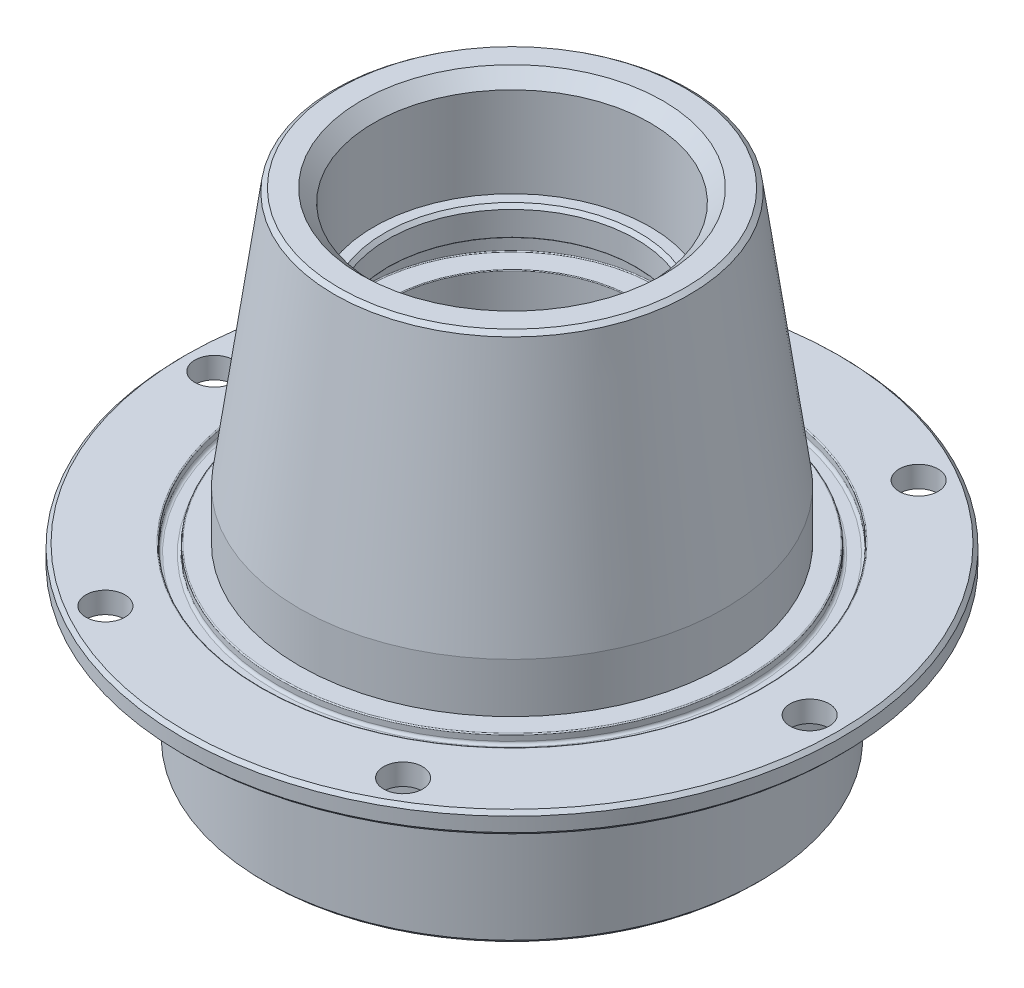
SolidWorks part; units mm, degrees
ref_plane "Face" through (0, 0, 0) normal (0, 0, 1) x (1, 0, 0)
ref_plane "Dessus" through (0, 0, 0) normal (0, 1, 0) x (1, 0, 0)
ref_plane "Droite" through (0, 0, 0) normal (1, 0, 0) x (0, 0, -1)
sketch "Esquisse1" plane through (0, 0, 0) normal (0, 0, 1) x (1, 0, 0)
  line L0 (0, 58.1117) -> (0, -113.1802) construction
  line L1 (-19.5, 0) -> (-25, 0)
  line L2 (-25, 0) -> (-30, -36.4064)
  line L3 (-19.5, 0) -> (-19.5, -14.5)
  line L4 (-19.5, -14.5) -> (-17.5, -14.5)
  line L5 (-30, -36.4064) -> (-30, -43.4064)
  line L6 (-17.5, -14.5) -> (-17.5, -18.5)
  line L7 (-17.5, -46.5) -> (-27, -46.5)
  line L8 (-27, -46.5) -> (-27, -47)
  line L9 (-27, -47) -> (-31, -47)
  line L10 (-31, -47) -> (-31, -61)
  line L11 (-31, -63.2) -> (-31, -67.7)
  line L12 (-31, -61) -> (-32.5, -61)
  line L13 (-31, -67.7) -> (-35, -67.7)
  line L14 (-31, -63.2) -> (-32.5, -63.2)
  line L15 (-32.5, -61) -> (-32.5, -63.2)
  line L16 (-35, -67.7) -> (-35, -46.4064)
  line L17 (-35, -46.4064) -> (-46.5, -46.4064)
  line L18 (-46.5, -46.4064) -> (-46.5, -43.4064)
  line L19 (-46.5, -43.4064) -> (-35.28, -43.4064)
  line L20 (-33, -43.4064) -> (-30, -43.4064)
  line L21 (-17.5, -42.9) -> (-17.5, -46.5)
  line L22 (-35.28, -43.4064) -> (-35.28, -44.7064)
  line L23 (-35.28, -44.7064) -> (-33, -44.7064)
  line L24 (-33, -43.4064) -> (-33, -44.7064)
  line L25 (-17.5, -18.5) -> (-20.72, -18.5)
  line L26 (-17.5, -22.4) -> (-17.5, -39)
  line L27 (-17.5, -22.4) -> (-20.72, -22.4)
  line L28 (-20.72, -18.5) -> (-20.72, -22.4)
  line L29 (-17.5, -39) -> (-20.72, -39)
  line L31 (-17.5, -42.9) -> (-20.72, -42.9)
  line L32 (-20.72, -39) -> (-20.72, -42.9)
  dimension "D2" = 7.82
  dimension "D3" = 14.5
  dimension "D4" = 19.5
  dimension "D5" = 30
  dimension "D6" = 7
  dimension "D7" = 17.5
  dimension "D8" = 46.5
  dimension "D9" = 27
  dimension "D10" = 0.5
  dimension "D11" = 31
  dimension "D12" = 2.2
  dimension "D13" = 32.5
  dimension "D14" = 16.2
  dimension "D15" = 67.7
  dimension "D16" = 35
  dimension "D17" = 3
  dimension "D18" = 46.5
  dimension "D19" = 2.28
  dimension "D20" = 1.3
  dimension "D21" = 33
  dimension "D22" = 25
  dimension "D23" = 3.9
  dimension "D24" = 3.9
  dimension "D25" = 3.22
  dimension "D26" = 3.22
  dimension "D27" = 18.5
  dimension "D28" = 20.5
revolve "Révolution1" add sketch "Esquisse1" angle 360 about L0
chamfer "Chanfrein1" distance 1.8 angle 45 1 edges at (0, 0, 19.5)
chamfer "Chanfrein2" distance 0.5 angle 45 7 edges at (0, -43.4064, 46.5) (0, -46.4064, 46.5) (0, -67.7, 31) (0, -46.5, 17.5) (0, -14.5, 17.5) (0, 0, 25) (0, -67.7, 35)
fillet "Congé1" radius 1 1 edges at (0, -46.4064, 35)
fillet "Congé2" radius 0.15 2 edges at (0, -43.4064, 33) (0, -43.4064, 35.28)
fillet "Congé3" radius 0.4 2 edges at (0, -44.7064, 35.28) (0, -44.7064, 33)
fillet "Congé4" radius 0.1 4 edges at (0, -42.9, 17.5) (0, -39, 17.5) (0, -22.4, 17.5) (0, -18.5, 17.5)
fillet "Congé5" radius 0.13 4 edges at (0, -22.4, 20.72) (0, -18.5, 20.72) (0, -39, 20.72) (0, -42.9, 20.72)
ref_plane "Plan1" through (0, -20.45, 0) normal (0, 1, 0) x (-1, 0, 0)
ref_plane "Plan2" through (0, -40.95, 0) normal (0, 1, 0) x (-1, 0, 0)
sketch "Esquisse3" plane through (0, -43.4064, 0) normal (0, 1, 0) x (1, 0, 0)
  line L0 (-50, 0) -> (50, 0) construction
  circle A0 centre (-42, 0) radius 2.75
  dimension "D1" = 5.5
  dimension "D2" = 42
extrude "Perçage" cut sketch "Esquisse3" against normal blind 3
pattern_circular "Répétition circulaire1" count 6 every 60 about axis through (0, 0, 0) along (0, 1, 0) of "Perçage"
sketch "Esquisse2" plane through (0, 0, 0) normal (0, 0, 1) x (1, 0, 0)
  line L1 (-51.2852, 8.4005) -> (51.6581, 8.4005)
  line L2 (-51.2852, 8.4005) -> (-51.2852, -78.5046)
  line L3 (-51.2852, -78.5046) -> (51.6581, -78.5046)
  line L4 (51.6581, 8.4005) -> (51.6581, -78.5046)
extrude "Coupe" [suppressed] cut sketch "Esquisse2" along normal blind 50
